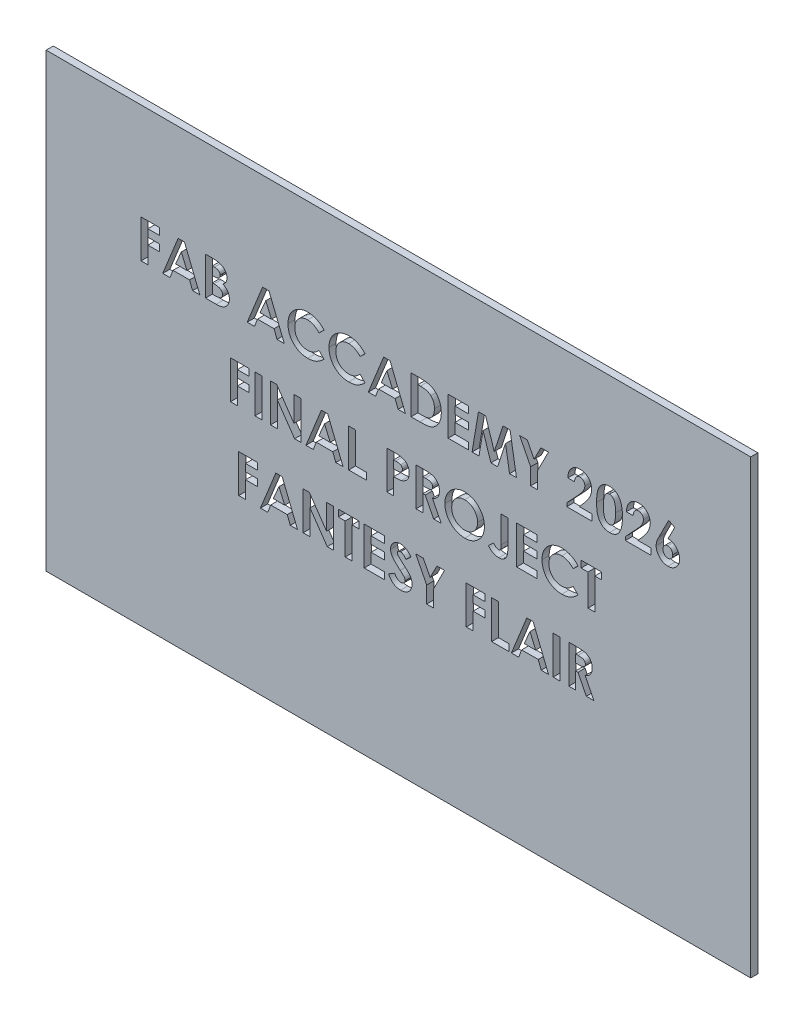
SolidWorks part; units mm, degrees
ref_plane "Front Plane" through (0, 0, 0) normal (0, 0, 1) x (1, 0, 0)
ref_plane "Top Plane" through (0, 0, 0) normal (0, 1, 0) x (1, 0, 0)
ref_plane "Right Plane" through (0, 0, 0) normal (1, 0, 0) x (0, 0, -1)
sketch "Sketch1" plane through (0, 0, 0) normal (0, 0, 1) x (1, 0, 0)
  line L1 (-74, 98.5) -> (74, 98.5)
  line L2 (-74, 98.5) -> (-74, 3.7071)
  line L3 (-74, 3.7071) -> (74, 3.7071)
  line L4 (74, 98.5) -> (74, 3.7071)
  point P4 (74, 3.7071)
  point P5 (-74, 3.7071)
base flange "Base-Flange1" sketch "Sketch1" thickness 1.5 reverse thickness direction yes parameters "D1"=5
sketch "Sketch6" plane through (0, 0, 1.5) normal (0, 0, 1) x (1, 0, 0)
  text T0 "<b>FAB ACCADEMY 2026</b>" font "Century Gothic" height 8
  text T1 "<b>FINAL PROJECT</b>" font "Century Gothic" height 8
  text T2 "<b>FANTESY FLAIR</b>" font "Century Gothic" height 8
extrude "Cut-Extrude1" cut sketch "Sketch6" against normal blind 10
sketch "Bend-Lines1" [suppressed] plane through (0, 0, 0) normal (0, 1, 0) x (1, 0, 0)
sketch "Bounding-Box1" [suppressed] plane through (0, 0, 0) normal (0, 1, 0) x (1, 0, 0)
sheet metal parameters "Sheet-Metal1" thickness 1.5 parameters "D1"=5
flat pattern "Flat-Pattern1"
sketch "Bend-Lines2" plane through (0, 0, 0) normal (0, 1, 0) x (1, 0, 0)
sketch3d "Bounding-Box2" [suppressed]
  line L0 (-74, 3.7071, 0) -> (74, 3.7071, 0) construction
  line L1 (-74, 98.5, 0) -> (74, 98.5, 0) construction
  line L2 (-74, 3.7071, 0) -> (-74, 98.5, 0) construction
  line L3 (74, 3.7071, 0) -> (74, 98.5, 0) construction
sheet metal parameters "Sheet-Metal2" thickness 1.5 parameters "D1"=5
flat pattern "Flat-Pattern2"
sketch "Bend-Lines3" plane through (0, 0, 0) normal (0, 1, 0) x (1, 0, 0)
sketch3d "Bounding-Box3" [suppressed]
  line L0 (74, 3.7071, 0) -> (-74, 3.7071, 0) construction
  line L1 (74, 98.5, 0) -> (-74, 98.5, 0) construction
  line L2 (74, 3.7071, 0) -> (74, 98.5, 0) construction
  line L3 (-74, 3.7071, 0) -> (-74, 98.5, 0) construction
sheet metal parameters "Sheet-Metal3" thickness 1.5 parameters "D1"=5
flat pattern "Flat-Pattern3"
sketch "Bend-Lines4" plane through (0, 0, 0) normal (0, 1, 0) x (1, 0, 0)
sketch3d "Bounding-Box4" [suppressed]
  line L0 (-16.5326, 55.0449, 0) -> (-16.7162, 60.5773, 0) construction
  line L1 (-11.102, 55.2251, 0) -> (-11.2856, 60.7575, 0) construction
  line L2 (-16.5326, 55.0449, 0) -> (-11.102, 55.2251, 0) construction
  line L3 (-16.7162, 60.5773, 0) -> (-11.2856, 60.7575, 0) construction
sheet metal parameters "Sheet-Metal4" thickness 1.5 parameters "D1"=5
flat pattern "Flat-Pattern4"
sketch "Bend-Lines5" plane through (0, 0, 0) normal (0, 1, 0) x (1, 0, 0)
sketch3d "Bounding-Box5" [suppressed]
  line L0 (-7.5673, 71.5621, 0) -> (-7.5674, 76.6903, 0) construction
  line L1 (-4.0802, 71.5621, 0) -> (-4.0802, 76.6903, 0) construction
  line L2 (-7.5673, 71.5621, 0) -> (-4.0802, 71.5621, 0) construction
  line L3 (-7.5674, 76.6903, 0) -> (-4.0802, 76.6903, 0) construction
sheet metal parameters "Sheet-Metal5" thickness 1.5 parameters "D1"=5
flat pattern "Flat-Pattern5"
sketch "Bend-Lines6" plane through (0, 0, 0) normal (0, 1, 0) x (1, 0, 0)
sketch3d "Bounding-Box6" [suppressed]
  line L0 (-45.5876, 71.3431, 0) -> (-45.6494, 76.8809, 0) construction
  line L1 (-43.0247, 71.3717, 0) -> (-43.0865, 76.9095, 0) construction
  line L2 (-45.5876, 71.3431, 0) -> (-43.0247, 71.3717, 0) construction
  line L3 (-45.6494, 76.8809, 0) -> (-43.0865, 76.9095, 0) construction
sheet metal parameters "Sheet-Metal6" thickness 1.5 parameters "D1"=5
flat pattern "Flat-Pattern6"
sketch "Bend-Lines7" plane through (0, 0, 0) normal (0, 1, 0) x (1, 0, 0)
sketch3d "Bounding-Box7" [suppressed]
  line L0 (-28.8265, 43.5478, 0) -> (-28.8265, 40.7706, 0) construction
  line L1 (-26.429, 43.5478, 0) -> (-26.429, 40.7706, 0) construction
  line L2 (-28.8265, 43.5478, 0) -> (-26.429, 43.5478, 0) construction
  line L3 (-28.8265, 40.7706, 0) -> (-26.429, 40.7706, 0) construction
sheet metal parameters "Sheet-Metal7" thickness 1.5 parameters "D1"=5
flat pattern "Flat-Pattern7"
sketch "Bend-Lines8" plane through (0, 0, 0) normal (0, 1, 0) x (1, 0, 0)
sketch "Bounding-Box8" [suppressed] plane through (0, 0, 0) normal (0, 1, 0) x (1, 0, 0)
sheet metal parameters "Sheet-Metal8" thickness 1.5 parameters "D1"=5
flat pattern "Flat-Pattern8"
sketch "Bend-Lines9" plane through (0, 0, 0) normal (0, 1, 0) x (1, 0, 0)
sketch "Bounding-Box9" [suppressed] plane through (0, 0, 0) normal (0, 1, 0) x (1, 0, 0)
sheet metal parameters "Sheet-Metal9" thickness 1.5 parameters "D1"=5
flat pattern "Flat-Pattern9"
sketch "Bend-Lines10" plane through (0, 0, 0) normal (0, 1, 0) x (1, 0, 0)
sketch "Bounding-Box10" [suppressed] plane through (0, 0, 0) normal (0, 1, 0) x (1, 0, 0)
sheet metal parameters "Sheet-Metal10" thickness 1.5 parameters "D1"=5
flat pattern "Flat-Pattern10"
sketch "Bend-Lines11" plane through (0, 0, 0) normal (0, 1, 0) x (1, 0, 0)
sketch "Bounding-Box11" [suppressed] plane through (0, 0, 0) normal (0, 1, 0) x (1, 0, 0)
sheet metal parameters "Sheet-Metal11" thickness 1.5 parameters "D1"=5
flat pattern "Flat-Pattern11"
sketch "Bend-Lines12" plane through (0, 0, 0) normal (0, 1, 0) x (1, 0, 0)
sketch "Bounding-Box12" [suppressed] plane through (0, 0, 0) normal (0, 1, 0) x (1, 0, 0)
sheet metal parameters "Sheet-Metal12" thickness 1.5 parameters "D1"=5
flat pattern "Flat-Pattern12"
sketch "Bend-Lines13" plane through (0, 0, 0) normal (0, 1, 0) x (1, 0, 0)
sketch3d "Bounding-Box13" [suppressed]
  line L0 (-57.5435, 73.6765, 0) -> (-57.6879, 71.4282, 0) construction
  line L1 (-55.4987, 73.5452, 0) -> (-55.6431, 71.2969, 0) construction
  line L2 (-57.5435, 73.6765, 0) -> (-55.4987, 73.5452, 0) construction
  line L3 (-57.6879, 71.4282, 0) -> (-55.6431, 71.2969, 0) construction
sheet metal parameters "Sheet-Metal13" thickness 1.5 parameters "D1"=5
flat pattern "Flat-Pattern13"
sketch "Bend-Lines14" plane through (0, 0, 0) normal (0, 1, 0) x (1, 0, 0)
sketch3d "Bounding-Box14" [suppressed]
  line L0 (39.0993, 73.6134, 0) -> (36.9455, 73.6134, 0) construction
  line L1 (39.0993, 71.5621, 0) -> (36.9455, 71.5621, 0) construction
  line L2 (39.0993, 73.6134, 0) -> (39.0993, 71.5621, 0) construction
  line L3 (36.9455, 73.6134, 0) -> (36.9455, 71.5621, 0) construction
sheet metal parameters "Sheet-Metal14" thickness 1.5 parameters "D1"=5
flat pattern "Flat-Pattern14"
sketch "Bend-Lines15" plane through (0, 0, 0) normal (0, 1, 0) x (1, 0, 0)
sketch3d "Bounding-Box15" [suppressed]
  line L0 (-37.2175, 42.6167, 0) -> (-39.2688, 42.6167, 0) construction
  line L1 (-37.2175, 44.2578, 0) -> (-39.2688, 44.2578, 0) construction
  line L2 (-37.2175, 42.6167, 0) -> (-37.2175, 44.2578, 0) construction
  line L3 (-39.2688, 42.6167, 0) -> (-39.2688, 44.2578, 0) construction
sheet metal parameters "Sheet-Metal15" thickness 1.5 parameters "D1"=5
flat pattern "Flat-Pattern15"
sketch "Bend-Lines16" plane through (0, 0, 0) normal (0, 1, 0) x (1, 0, 0)
sketch "Bounding-Box16" [suppressed] plane through (0, 0, 0) normal (0, 1, 0) x (1, 0, 0)
sheet metal parameters "Sheet-Metal16" thickness 1.5 parameters "D1"=5
flat pattern "Flat-Pattern16"
sketch "Bend-Lines17" plane through (0, 0, 0) normal (0, 1, 0) x (1, 0, 0)
sketch3d "Bounding-Box17" [suppressed]
  line L0 (1.0143, 58.8242, 0) -> (-0.8319, 58.8242, 0) construction
  line L1 (1.0143, 60.4652, 0) -> (-0.8319, 60.4652, 0) construction
  line L2 (1.0143, 58.8242, 0) -> (1.0143, 60.4652, 0) construction
  line L3 (-0.8319, 58.8242, 0) -> (-0.8319, 60.4652, 0) construction
sheet metal parameters "Sheet-Metal17" thickness 1.5 parameters "D1"=5
flat pattern "Flat-Pattern17"
sketch "Bend-Lines18" plane through (0, 0, 0) normal (0, 1, 0) x (1, 0, 0)
sketch3d "Bounding-Box18" [suppressed]
  line L0 (37.4583, 74.9467, 0) -> (37.4583, 76.6903, 0) construction
  line L1 (39.0993, 74.9467, 0) -> (39.0993, 76.6903, 0) construction
  line L2 (37.4583, 74.9467, 0) -> (39.0993, 74.9467, 0) construction
  line L3 (37.4583, 76.6903, 0) -> (39.0993, 76.6903, 0) construction
